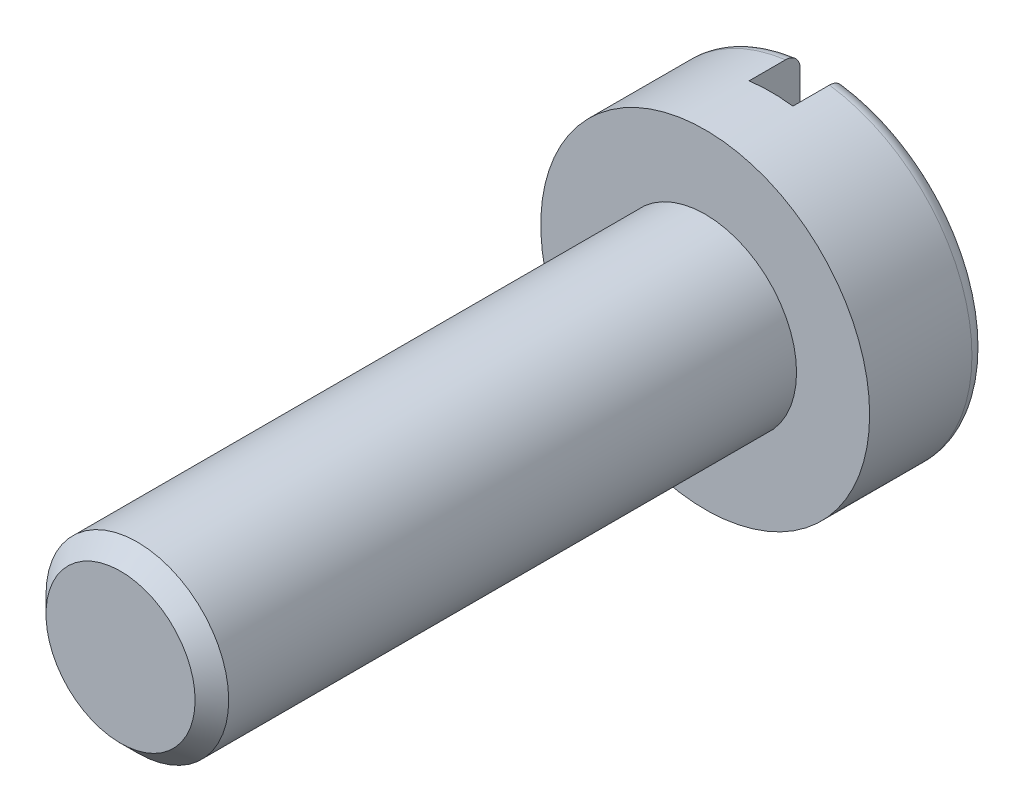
SolidWorks part; units mm, degrees
ref_plane "Plan1" through (0, 0, 0) normal (0, 0, 1) x (1, 0, 0)
ref_plane "Plan2" through (0, 0, 0) normal (0, 1, 0) x (1, 0, 0)
ref_plane "Plan3" through (0, 0, 0) normal (1, 0, 0) x (0, 0, -1)
sketch "Esquisse1" plane through (0, 0, 0) normal (0, 0, 1) x (1, 0, 0)
  circle A0 centre (0, 0) radius 2.25
  dimension "D1" = 4.5
extrude "Base-Extrusion" add sketch "Esquisse1" against normal blind 1.6
sketch "Esquisse2" plane through (0, 0, 0) normal (0, 0, 1) x (1, 0, 0)
  circle A0 centre (0, 0) radius 1.25
  dimension "D1" = 2.5
extrude "Boss.-Extru.1" add sketch "Esquisse2" along normal blind 8
chamfer "Chanfrein1" distance 0.23 angle 45
fillet "Congé1" radius 0.2
sketch "Esquisse3" plane through (0, 0, -1.6) normal (0, 0, -1) x (-1, 0, 0)
  line L0 (0, 2) -> (0, -3) construction
  line L1 (-0.3, 2.25) -> (0.3, 2.25)
  line L2 (-0.3, 2.25) -> (-0.3, -2.25)
  line L3 (-0.3, -2.25) -> (0.3, -2.25)
  line L4 (0.3, 2.25) -> (0.3, -2.25)
  circle A0 centre (0, 0) radius 2.25 construction
  dimension "D1" = 0.6
extrude "Enlèv. mat.-Extru.1" cut sketch "Esquisse3" against normal blind 0.7
